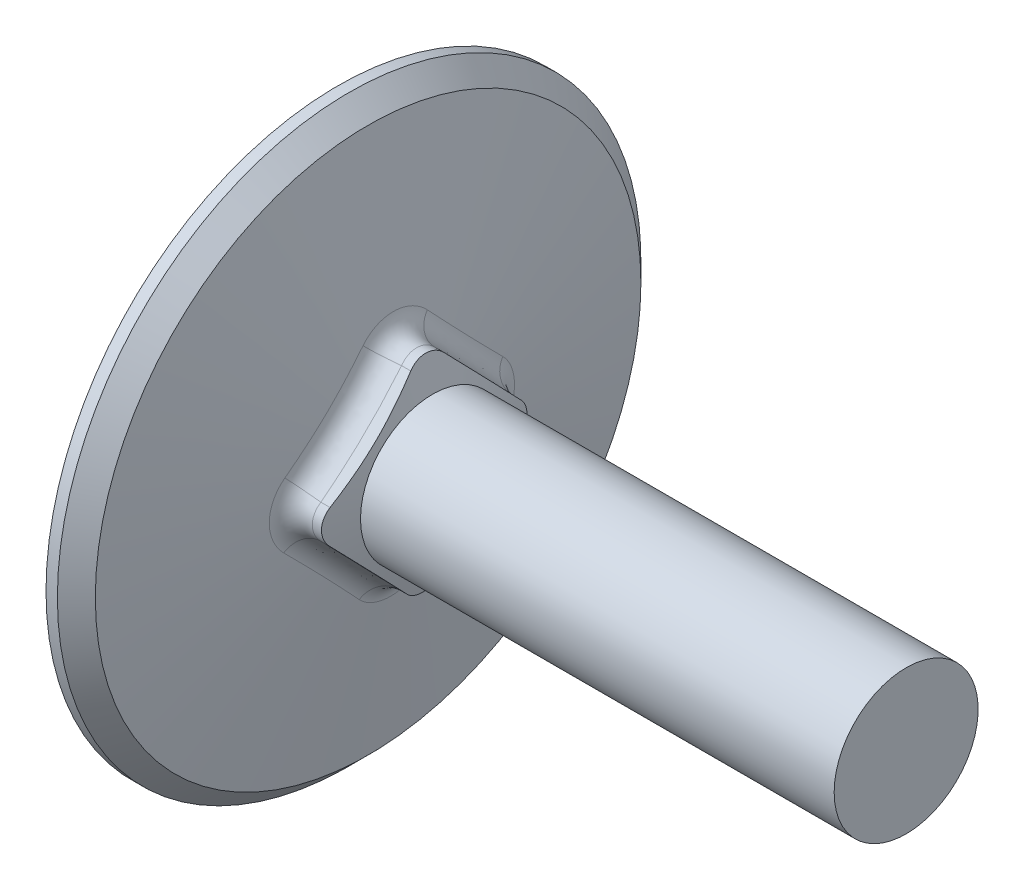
SolidWorks part; units mm, degrees
ref_plane "Plane1" through (0, 0, 0) normal (0, 0, 1) x (1, 0, 0)
ref_plane "Plane2" through (0, 0, 0) normal (0, 1, 0) x (1, 0, 0)
ref_plane "Plane3" through (0, 0, 0) normal (1, 0, 0) x (0, 0, -1)
revolve "BaseBody" add sketch "BodySke"
sketch "BodySke" plane through (0, 0, 0) normal (0, 0, 1) x (1, 0, 0)
  line L0 (0, 0) -> (0, 9.779)
  line L1 (0, 9.779) -> (0.381, 9.779)
  line L2 (2.0828, 2.413) -> (19.05, 2.413)
  line L3 (19.05, 2.413) -> (19.05, 0)
  line L4 (19.05, 0) -> (0, 0)
  line L5 (-6.35, 0) -> (82.55, 0) construction
  line L6 (2.0828, -2.413) -> (19.05, -2.413) construction
  line L7 (0, -9.779) -> (0.381, -9.779) construction
  line L8 (1.0168, 9.1432) -> (2.0828, 2.413)
  line L9 (17.9908, 12.7) -> (17.9908, -3.175) construction
  line L10 (0.381, 9.779) -> (1.0168, 9.1432)
  line L11 (0, 12.7) -> (0, -3.175) construction
  dimension "D1" = 0.381
  dimension "Diameter" = 4.826
  dimension "D2" = 45
  dimension "Length" = 19.05
  dimension "Head_ht" = 2.0828
  dimension "Head_dia" = 19.558
  dimension "Head_ang" = 9
  dimension "Advance" = 1.0592
  dimension "Thread_nom" = 19.05
revolve "NeckChamfer" cut sketch "Sketch3" angle 360 about L4
sketch "Sketch3" plane through (0, 0, 0) normal (0, 0, 1) x (1, 0, 0)
  line L0 (-2.2017, 22.479) -> (3.175, 2.413)
  line L1 (3.175, 2.413) -> (3.429, 2.413)
  line L2 (3.429, 2.413) -> (3.429, 22.479)
  line L3 (3.429, 22.479) -> (-2.2017, 22.479)
  line L4 (0, 0) -> (22.225, 0) construction
  line L9 (0.381, 9.779) -> (0, 9.779) construction
  dimension "D1" = 12.7
  dimension "D2" = 2.413
  dimension "D3" = 105
  dimension "D4" = 0.254
  dimension "D5" = 3.175
fillet "HeadFillet" radius 0.7874 8 edges at (1.9869, 0.8359, -2.9003) (1.9199, 0.0292, -3.4415) (1.9869, -2.9003, -0.836) (1.9199, -3.4415, -0.0292) (1.9869, -0.8359, 2.9003) (1.9199, -0.0292, 3.4415) (1.9869, 2.9003, 0.836) (1.9199, 3.4415, 0.0292)
extrude "Neck" add sketch "Sketch2" along normal blind 3.175
sketch "Sketch2" plane through (0, 0, 0) normal (1, 0, 0) x (0, 0.6947, -0.7193)
  line L1 (1.8796, -2.667) -> (-1.8796, -2.667)
  line L2 (2.667, -1.8796) -> (2.667, 1.8796)
  line L3 (1.8796, 2.667) -> (-1.8796, 2.667)
  line L4 (-2.667, -1.8796) -> (-2.667, 1.8796)
  arc A0 (1.8796, 2.667) -> (2.667, 1.8796) centre (1.8796, 1.8796) cw
  arc A1 (1.8796, -2.667) -> (2.667, -1.8796) centre (1.8796, -1.8796) ccw
  arc A2 (-2.667, -1.8796) -> (-1.8796, -2.667) centre (-1.8796, -1.8796) ccw
  arc A3 (-1.8796, 2.667) -> (-2.667, 1.8796) centre (-1.8796, 1.8796) ccw
  dimension "Neck_corner_radius" = 0.7874
  dimension "D1" = 2.667
  dimension "Neck_width" = 5.334
  dimension "D2" = 5.334
  dimension "D3" = 2.667
sketch "ThdSchSke" plane through (0, 0, 0) normal (0, 0, 1) x (1, 0, 0)
  line L0 (4.7638, -1.7831) -> (4.3227, -2.413)
  line L1 (4.7638, -1.7831) -> (5.2049, -2.413)
  line L2 (5.2049, -2.413) -> (5.2049, -3.0163)
  line L3 (-3.175, 0) -> (5.1513, 0) construction
  line L5 (5.2049, -3.0163) -> (4.3227, -3.0163)
  line L6 (4.3227, -3.0163) -> (4.3227, -2.413)
  line L7 (0, 9.779) -> (0, -9.779) construction
  dimension "Thread_minor" = 3.5662
  dimension "Diameter" = 4.826
  dimension "Start" = 4.7638
  dimension "SideAngle" = 55
  dimension "VeeAngle" = 70
  dimension "Overcut" = 6.0325
revolve "ThreadSchematic" [suppressed] cut sketch "ThdSchSke" angle 360 about L3
pattern_linear "ThdSchPat" [suppressed]
equation "\"D1@Sketch2\" = \"Neck_width@Sketch2\"/2"
equation "\"D2@Sketch2\" = \"Neck_width@Sketch2\""
equation "\"D3@Sketch2\" = \"D2@Sketch2\"/2"
equation "\"D2@Sketch3\" = \"Diameter@BodySke\"/2"
equation "\"D5@Sketch3\" = \"Neck_ht@Neck\""
equation "\"Thread_length@ThreadCosmetic\" = ((sgn( (\"Length@BodySke\" - \"Advance@BodySke\" * 1.5 - \"Neck_ht@Neck\" ) - \"Thread_nom@BodySke\" )-1)*( (\"Length@BodySke\" - \"Advance@BodySke\" * 1.5 - \"Neck_ht@Neck\" ) - \"T"
equation "\"Thread_minor@ThdSchSke\" = \"Thread_minor@ThreadCosmetic\""
equation "\"Diameter@ThdSchSke\" = \"Diameter@BodySke\""
equation "\"Overcut@ThdSchSke\" = \"Diameter@BodySke\" * 1.25"
equation "\"Start@ThdSchSke\" = 0.000001 + \"Length@BodySke\" - \"Thread_length@ThreadCosmetic\"  '---Countersunk---"
equation "\"Num_threads@ThdSchPat\" = int( \"Thread_length@ThreadCosmetic\" / \"Advance@BodySke\" + 0.999 )  + 1"
equation "\"Advance@ThdSchPat\" = \"Thread_length@ThreadCosmetic\" /  (\"Num_threads@ThdSchPat\" - 1) 'relax it"
